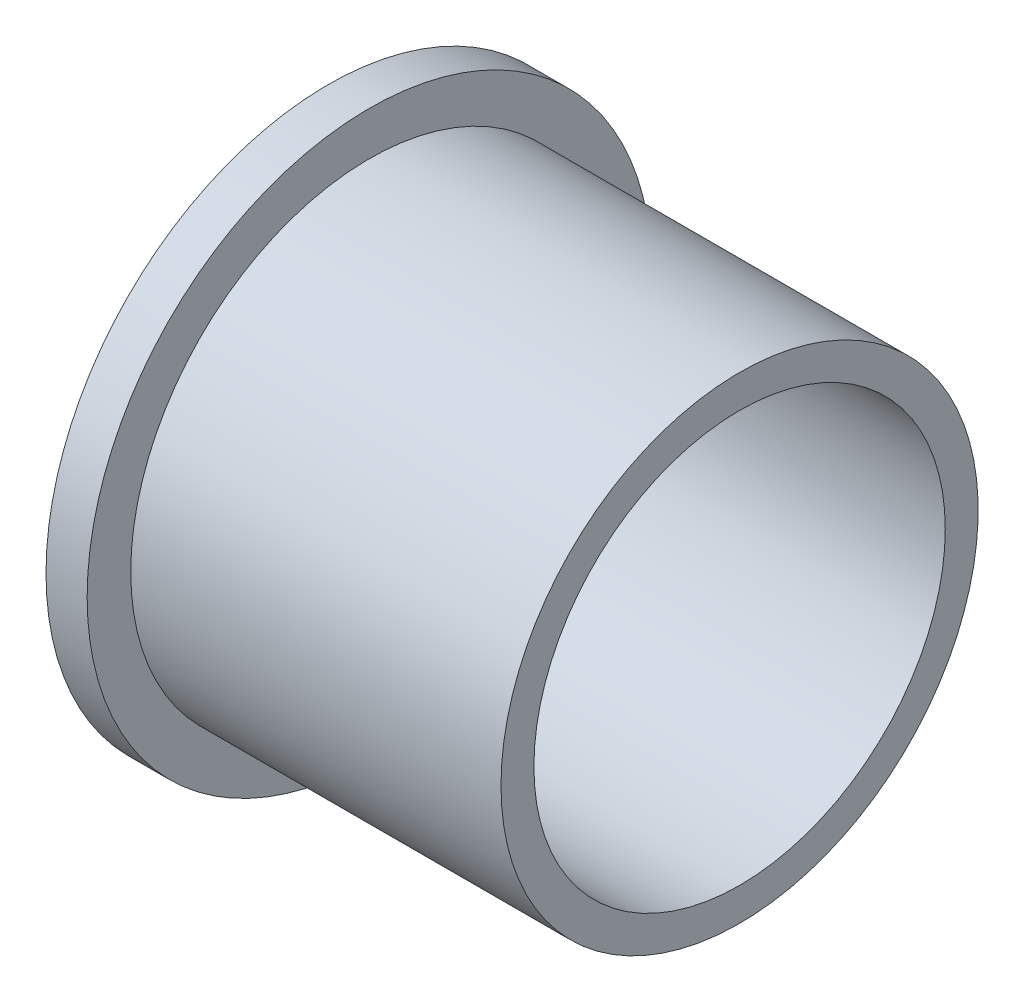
SolidWorks part; units mm, degrees
ref_plane "Plane1" through (0, 0, 0) normal (0, 0, 1) x (1, 0, 0)
ref_plane "Plane2" through (0, 0, 0) normal (0, 1, 0) x (1, 0, 0)
ref_plane "Plane3" through (0, 0, 0) normal (1, 0, 0) x (0, 0, -1)
sketch "Esquisse1" plane through (0, 0, 0) normal (0, 0, 1) x (1, 0, 0)
  line L0 (0, -25) -> (0, -34.3)
  line L1 (0, -34.3) -> (5, -34.3)
  line L2 (5, -34.3) -> (5, -29)
  line L3 (5, -29) -> (50, -29)
  line L4 (50, -29) -> (50, -25)
  line L5 (50, -25) -> (0, -25)
  line L6 (0, 0) -> (77.3237, 0) construction
  dimension "D1" = 25
  dimension "D2" = 29
  dimension "D3" = 50
  dimension "D4" = 34.3
  dimension "D5" = 5
revolve "Base-Révolution" add sketch "Esquisse1" angle 360 about L6
